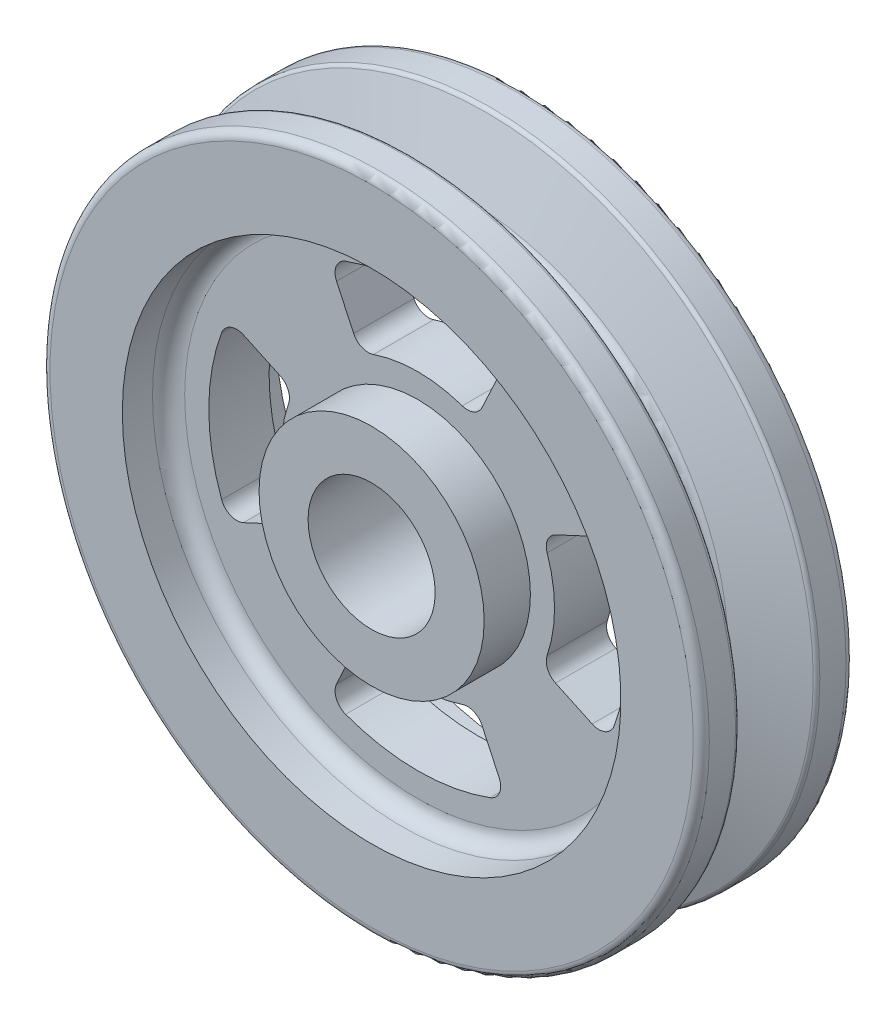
SolidWorks part; units mm, degrees
ref_plane "正面" through (0, 0, 0) normal (0, 0, 1) x (1, 0, 0)
ref_plane "平面" through (0, 0, 0) normal (0, 1, 0) x (1, 0, 0)
ref_plane "右側面" through (0, 0, 0) normal (1, 0, 0) x (0, 0, -1)
sketch "s-外形円" plane through (0, 0, 0) normal (0, 0, 1) x (1, 0, 0)
  circle A0 centre (0, 0) radius 41
  dimension "D1" = 82
sketch "s-基準円直径" plane through (0, 0, 0) normal (0, 0, 1) x (1, 0, 0)
  circle A0 centre (0, 0) radius 38.3 construction
  dimension "D1" = 76.6
sketch "ｽｹｯﾁ3" plane through (0, 0, 0) normal (0, 0, 1) x (1, 0, 0)
  circle A0 centre (0, 0) radius 41 construction
  circle A1 centre (0, 0) radius 41
extrude "ﾎﾞｽ - 押し出し1" add sketch "ｽｹｯﾁ3" along normal mid plane 19
sketch "s-ベルト溝" plane through (0, 0, 0) normal (1, 0, 0) x (0, 0, -1)
  line L0 (0, 0) -> (0, 41) construction
  line L2 (-4.8773, 41) -> (4.8773, 41)
  line L3 (4.8773, 41) -> (0, 25.9893)
  line L4 (0, 25.9893) -> (-4.8773, 41)
  line L5 (-4, 38.3) -> (4, 38.3) construction
  line L7 (0, 41) -> (0, -41) construction
  line L8 (9.5, 41) -> (-9.5, 41) construction
  dimension "D1" = 36
  dimension "D2" = 8
  dimension "D3" = 2.7
sketch "s-V溝" plane through (0, 0, 0) normal (1, 0, 0) x (0, 0, -1)
  line L0 (-9.5, 0) -> (9.5, 0) construction
  line L3 (-4, 38.3) -> (4, 38.3) construction
  line L4 (-4, 38.3) -> (4, 38.3) construction
  line L5 (-4, -38.3) -> (4, -38.3) construction
  line L6 (9.5, -41) -> (9.5, 41) construction
  line L7 (-9.5, 41) -> (-9.5, -41) construction
sketch "ｽｹｯﾁ6" plane through (0, 0, 0) normal (1, 0, 0) x (0, 0, -1)
  line L0 (-4.8773, 41) -> (4.8773, 41) construction
  line L1 (0, 25.9893) -> (-4.8773, 41) construction
  line L2 (4.8773, 41) -> (0, 25.9893) construction
  line L3 (-4.8773, 41) -> (4.8773, 41)
  line L4 (-1.953, 32) -> (-4.8773, 41)
  line L5 (4.8773, 41) -> (1.953, 32)
  line L6 (-1.953, 32) -> (1.953, 32)
  line L7 (-4, 38.3) -> (4, 38.3) construction
  dimension "D1" = 6.3
revolve "ｶｯﾄ - 回転1" cut sketch "ｽｹｯﾁ6" angle 360 about L0
sketch "ｽｹｯﾁ7" plane through (0, 0, 9.5) normal (0, 0, 1) x (1, 0, 0)
  circle A0 centre (0, 0) radius 14
  dimension "D1" = 28
extrude "ﾎﾞｽ - 押し出し2" add sketch "ｽｹｯﾁ7" against normal blind 38
sketch "ｽｹｯﾁ8" plane through (0, 0, -28.5) normal (0, 0, -1) x (-1, 0, 0)
  circle A0 centre (0, 0) radius 7.9
  dimension "D1" = 15.8
extrude "ｶｯﾄ - 押し出し1" cut sketch "ｽｹｯﾁ8" against normal through all
hole_wizard "M6x1.0 ねじ穴1" positions "ｽｹｯﾁ10" profile "ｽｹｯﾁ9" tap size "M6x1.0" standard "Jis"
sketch "ｽｹｯﾁ10" plane through (0, 0, 0) normal (0, 1, 0) x (1, 0, 0)
  line L0 (0, 0) -> (0, 21) construction
  line L2 (14, 28.5) -> (-14, 28.5) construction
  point P2 (0, 21)
  dimension "D1" = 7.5
sketch "ｽｹｯﾁ9" plane through (0, 0, -21) normal (1, 0, 0) x (0, 0, -1)
  line L0 (0, 0) -> (0, 14)
  line L1 (0, 14) -> (2.5, 14)
  line L2 (2.5, 14) -> (2.5, 0)
  line L5 (2.5, 0) -> (0, 0)
  line L11 (0, -6.35) -> (0, 107.95) construction
  dimension "次ｻｰﾌｪｽまでのねじ下穴ﾄﾞﾘﾙ直径" = 5
  dimension "次ｻｰﾌｪｽまでのねじ下穴ﾄﾞﾘﾙの深さ" = 14
sketch "ｽｹｯﾁ11" plane through (0, 0, 0) normal (1, 0, 0) x (0, 0, -1)
  line L0 (0, 0) -> (9.5, 0) construction
  line L1 (9.5, 14) -> (9.5, 31)
  line L4 (9.5, 31) -> (3.75, 31)
  line L5 (3.75, 31) -> (3.75, 14)
  line L6 (3.75, 14) -> (9.5, 14)
  line L7 (0, 0) -> (0, 32) construction
  line L9 (1.953, 32) -> (-1.953, 32) construction
  line L19 (18.5, 14) -> (9.5, 14) construction
  line L26 (9.5, -41) -> (9.5, 41) construction
  dimension "D1" = 7.5
  dimension "D2" = 62
revolve "ｶｯﾄ - 回転2" cut sketch "ｽｹｯﾁ11" angle 360 about axis through (0, 0, -28.5) along (0, 0, 1)
mirror "ﾐﾗｰ1" about plane through (0, 0, 0) normal (0, 0, 1) of "ｶｯﾄ - 回転2"
sketch "ｽｹｯﾁ13" plane through (0, 0, -3.75) normal (0, 0, -1) x (-1, 0, 0)
  line L0 (0, 0) -> (15.4072, 7.1845) construction
  line L1 (0, 0) -> (17, 0) construction
  line L2 (0, 0) -> (15.4072, -7.1845) construction
  line L3 (15.4072, 7.1845) -> (23.564, 10.9881)
  line L4 (15.4072, -7.1845) -> (23.564, -10.9881)
  arc A0 (15.4072, -7.1845) -> (15.4072, 7.1845) centre (0, 0) ccw
  arc A1 (23.564, -10.9881) -> (23.564, 10.9881) centre (0, 0) ccw
  point P1 (17, 0)
  dimension "D1" = 34
  dimension "D2" = 52
  dimension "D3" = 50
extrude "ｶｯﾄ - 押し出し2" cut sketch "ｽｹｯﾁ13" against normal through all
fillet "ﾌｨﾚｯﾄ1" radius 2 4 edges at (-15.4072, 7.1845, 0) (-15.4072, -7.1845, 0) (-23.564, -10.9881, 0) (-23.564, 10.9881, 0)
pattern_circular "円形ﾊﾟﾀｰﾝ1" count 4 over 360 about axis through (0, 0, 0) along (0, 0, 1) of "ｶｯﾄ - 押し出し2", "ﾌｨﾚｯﾄ1"
chamfer "面取り1" distance 1 angle 45 1 edges at (14, 0, -28.5)
fillet "ﾌｨﾚｯﾄ2" radius 1 4 edges at (32, 0, -1.953) (32, 0, 1.953) (41, 0, -9.5) (41, 0, 9.5)
fillet "ﾌｨﾚｯﾄ3" radius 0.5 2 edges at (41, 0, 4.8773) (41, 0, -4.8773)
fillet "ﾌｨﾚｯﾄ4" radius 2 2 edges at (-31, 0, 3.75) (-31, 0, -3.75)
